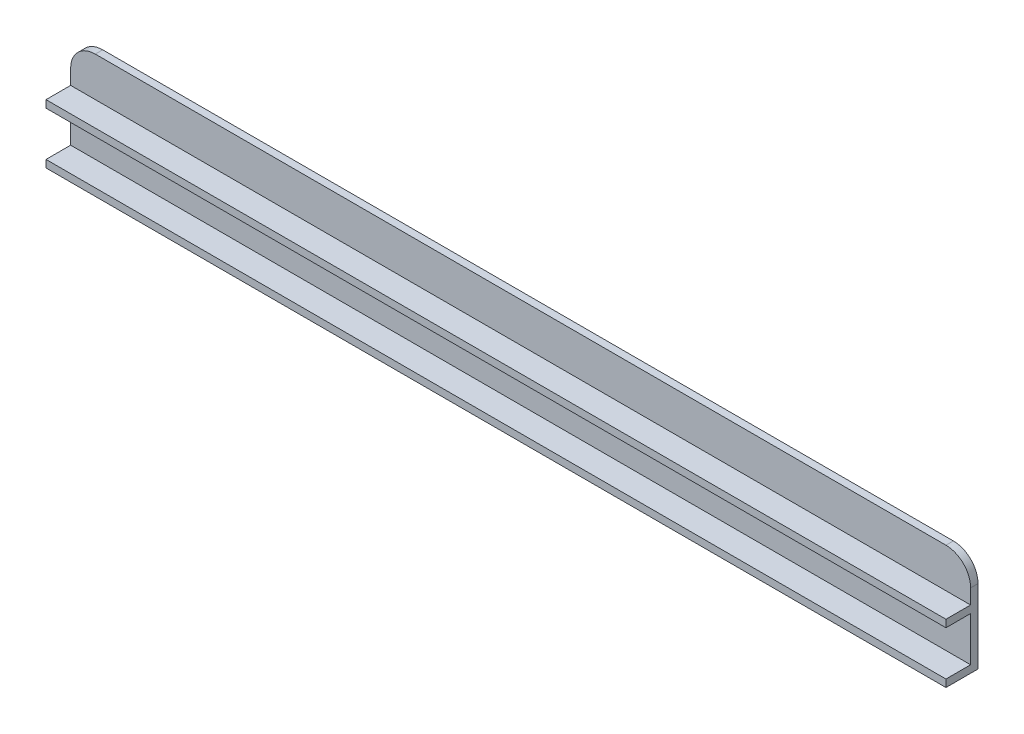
SolidWorks part; units mm, degrees
ref_plane "Front Plane" through (0, 0, 0) normal (0, 0, 1) x (1, 0, 0)
ref_plane "Top Plane" through (0, 0, 0) normal (0, 1, 0) x (1, 0, 0)
ref_plane "Right Plane" through (0, 0, 0) normal (1, 0, 0) x (0, 0, -1)
body saved out of another part "Stock-V1-1"
move or copy body "Body-Move/Copy1" bodies to move or copy 101 copy no rotation origin (65.25, 0, 148.25) rotation axis (0, 1, 0) rotation angle 180
